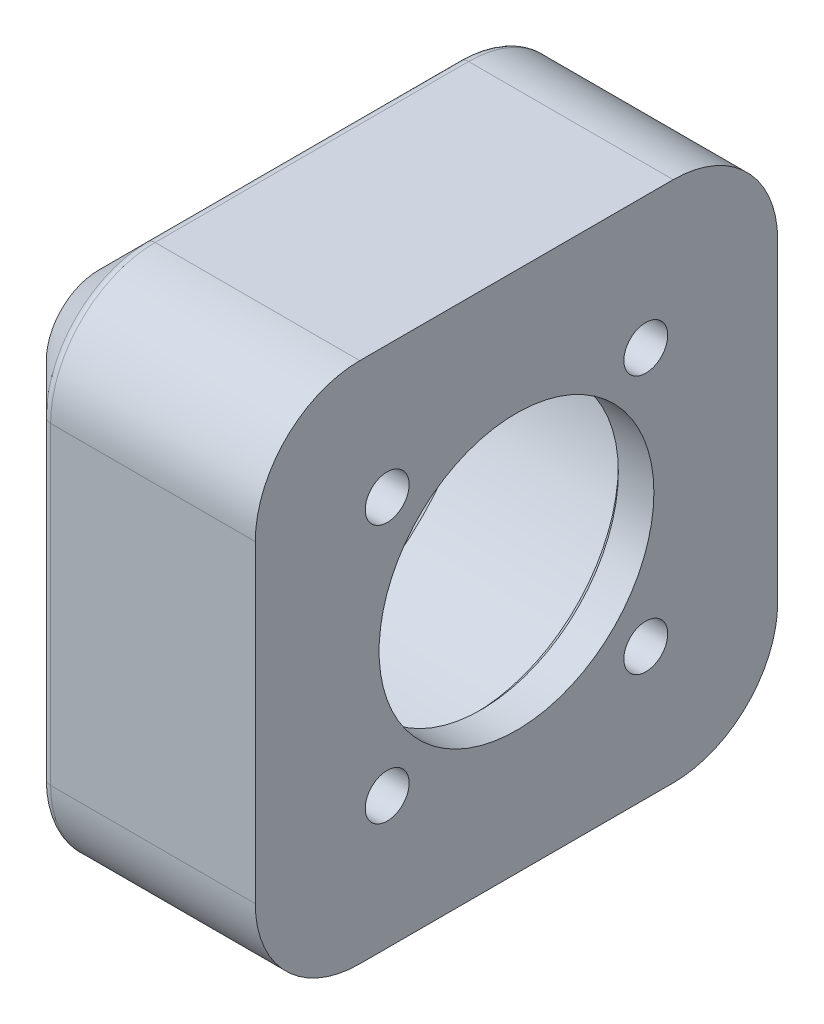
SolidWorks part; units mm, degrees
ref_plane "Front Plane" through (0, 0, 0) normal (0, 0, 1) x (1, 0, 0)
ref_plane "Top Plane" through (0, 0, 0) normal (0, 1, 0) x (1, 0, 0)
ref_plane "Right Plane" through (0, 0, 0) normal (1, 0, 0) x (0, 0, -1)
sketch "Croquis1" plane through (0, 0, 0) normal (1, 0, 0) x (0, 0, -1)
  line L1 (-25, 25) -> (25, 25)
  line L2 (-25, 25) -> (-25, -25)
  line L3 (-25, -25) -> (25, -25)
  line L4 (25, 25) -> (25, -25)
  line L5 (-25, 25) -> (25, -25) construction
  line L6 (-25, -25) -> (25, 25) construction
  circle A0 centre (0, 0) radius 21.15 construction
  circle A1 centre (0, 0) radius 13.15
  dimension "D1" = 42.3
  dimension "D3" = 26.3
  dimension "D2" = 50
  dimension "D4" = 50
extrude "Saliente-Extruir2" add sketch "Croquis1" along normal blind 4
sketch "Croquis2" plane through (0, 0, 0) normal (1, 0, 0) x (0, 0, -1)
  line L0 (12.3744, 12.3744) -> (0, 0) construction
  circle A0 centre (0, 0) radius 17.5 construction
  circle A1 centre (12.3744, 12.3744) radius 2.1
  circle A2 centre (12.3744, -12.3744) radius 2.1
  circle A3 centre (-12.3744, -12.3744) radius 2.1
  circle A4 centre (-12.3744, 12.3744) radius 2.1
  point P14 (0, 0)
  dimension "D1" = 35
  dimension "D2" = 45
  dimension "D3" = 4.2
  dimension "D4" = 4
extrude "Cortar-Extruir1" cut sketch "Croquis2" along normal through all
sketch "Croquis3" plane through (0, 0, 0) normal (1, 0, 0) x (0, 0, -1)
  line L4 (25, -25) -> (25, 25)
  line L5 (-25, -25) -> (25, -25)
  line L6 (-25, 25) -> (-25, -25)
  line L7 (25, 25) -> (-25, 25)
  line L8 (25, -25) -> (25, 25)
  line L9 (-25, -25) -> (25, -25)
  line L10 (-25, 25) -> (-25, -25)
  line L11 (25, 25) -> (-25, 25)
  circle A0 centre (0, 0) radius 21.15 construction
  circle A1 centre (0, 0) radius 21.15
  dimension "D1" = 0
extrude "Saliente-Extruir3" add sketch "Croquis3" against normal blind 21
fillet "Redondeo1" radius 10 4 edges at (-8.5, -25, -25) (-8.5, -25, 25) (-8.5, 25, -25) (-8.5, 25, 25)
chamfer "Chaflán1" distance 0.6 angle 45 1 edges at (0, 0, -13.15)
chamfer "Chaflán2" distance 5 angle 45 8 edges at (-21, -22.0711, -22.0711) (-21, -25, 0) (-21, 0, -25) (-21, -22.0711, 22.0711) (-21, 22.0711, -22.0711) (-21, 0, 25) (-21, 25, 0) (-21, 22.0711, 22.0711)
chamfer "Chaflán4" distance 1 angle 45 8 edges at (-21, -14.9553, -14.9553) (-19.85, 0, -21.15) (-19.85, -21.15, 0) (-21, -14.9553, 14.9553) (-19.85, 0, 21.15) (-21, 14.9553, 14.9553) (-19.85, 21.15, 0) (-21, 14.9553, -14.9553)
fillet "Redondeo3" radius 1 8 edges at (-16, 22.0711, 22.0711) (-16, 25, 0) (-16, 22.0711, -22.0711) (-16, 0, -25) (-16, -22.0711, -22.0711) (-16, -25, 0) (-16, -22.0711, 22.0711) (-16, 0, 25)
